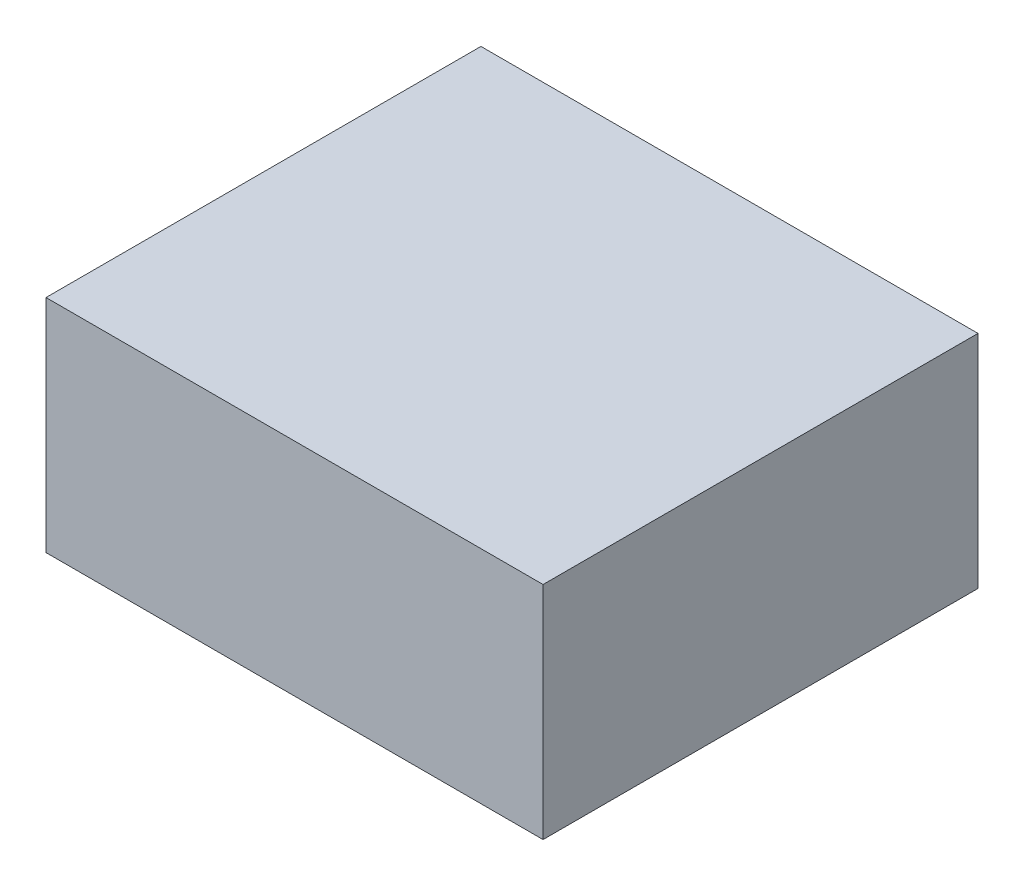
SolidWorks part; units mm, degrees
ref_plane "前视基准面" through (0, 0, 0) normal (0, 0, 1) x (1, 0, 0)
ref_plane "上视基准面" through (0, 0, 0) normal (0, 1, 0) x (1, 0, 0)
ref_plane "右视基准面" through (0, 0, 0) normal (1, 0, 0) x (0, 0, -1)
other "Configuration Table"
sketch "草图1" plane through (0, 0, 0) normal (0, 0, 1) x (1, 0, 0)
  line L1 (-18, -61) -> (18, -61)
  line L2 (-18, -61) -> (-18, -45)
  line L3 (-18, -45) -> (18, -45)
  line L4 (18, -61) -> (18, -45)
  line L5 (-18, -61) -> (18, -45) construction
  line L6 (-18, -45) -> (18, -61) construction
  point P0 (0, -53)
  dimension "D1" = 18
  dimension "D2" = 45
  dimension "D3" = 53
extrude "Rotor_to_Palm_Bridge" add sketch "草图1" against normal mid plane 31.5
